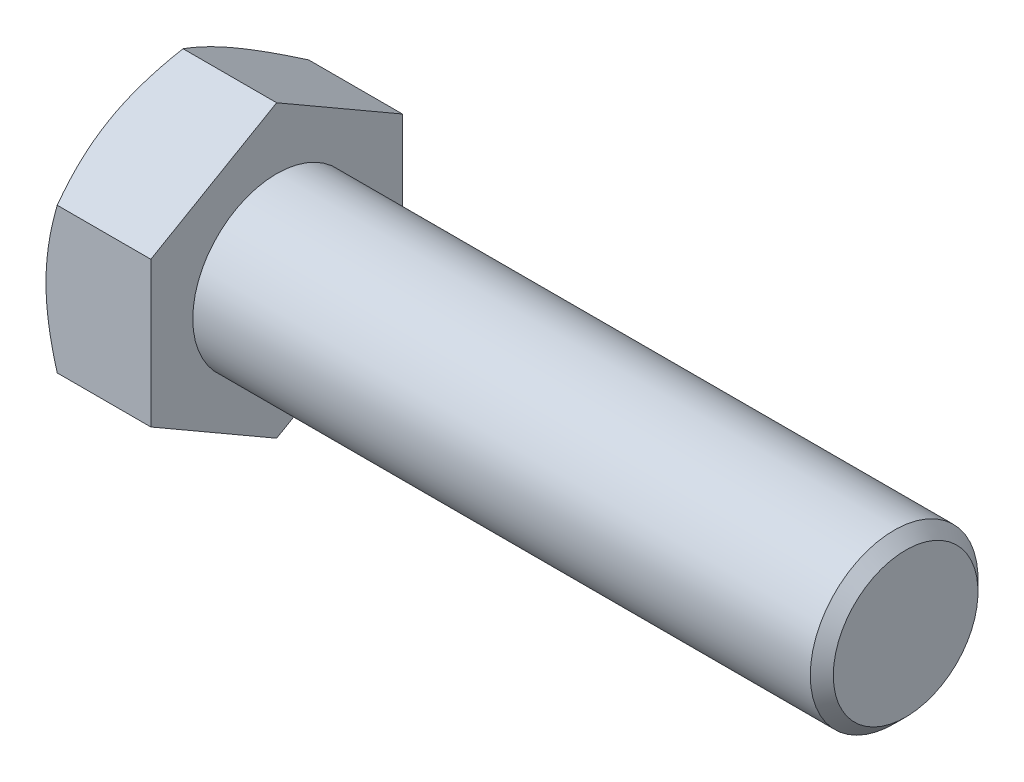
SolidWorks part; units mm, degrees
ref_plane "Front Plane" through (0, 0, 0) normal (0, 0, 1) x (1, 0, 0)
ref_plane "Top Plane" through (0, 0, 0) normal (0, 1, 0) x (1, 0, 0)
ref_plane "Right Plane" through (0, 0, 0) normal (1, 0, 0) x (0, 0, -1)
sketch "BaseHeadSke" plane through (0, 0, 0) normal (1, 0, 0) x (0, 0, -1)
  line L1 (0, 20.7846) -> (-18, 10.3923)
  line L2 (-18, 10.3923) -> (-18, -10.3923)
  line L3 (-18, -10.3923) -> (0, -20.7846)
  line L4 (0, -20.7846) -> (18, -10.3923)
  line L5 (18, -10.3923) -> (18, 10.3923)
  line L6 (18, 10.3923) -> (0, 20.7846)
  circle A0 centre (0, 0) radius 18 construction
  dimension "Width_flats" = 36
extrude "BaseHead" add sketch "BaseHeadSke" along normal blind 15
sketch "HeadChamferSke" plane through (0, 0, 0) normal (0, 0, 1) x (1, 0, 0)
  line L0 (0, 0) -> (59.4924, 0) construction
  line L1 (0, 10.3923) -> (0, -10.3923) construction
  line L2 (0, 20.7846) -> (0, 18)
  line L3 (0, 18) -> (1.6077, 20.7846)
  line L4 (1.6077, 20.7846) -> (0, 20.7846)
  line L7 (15, 20.7846) -> (0, 20.7846) construction
  dimension "Angle_Chamfer_Head" = 30
revolve "HeadChamfer" cut sketch "HeadChamferSke" angle 360 about L0
sketch "BodySke" plane through (0, 0, 0) normal (0, 0, 1) x (1, 0, 0)
  line L0 (0, 0) -> (134.9018, 0) construction
  line L1 (0, 0) -> (0, 12)
  line L2 (0, 12) -> (103.352, 12)
  line L3 (105, 10.352) -> (105, 0)
  line L4 (105, 0) -> (0, 0)
  line L5 (15, 10.3923) -> (15, -10.3923) construction
  line L6 (103.352, 12) -> (105, 10.352)
  line L7 (18, 0) -> (18, 20.3478) construction
  dimension "Diameter" = 24
  dimension "Length" = 90
  dimension "Thread_minor" = 20.704
  dimension "Body_Chamfer_Angle" = 45
  dimension "Advance" = 3
revolve "BaseBody" add sketch "BodySke" angle 360 about L0
sketch "BearingFaceSke" plane through (0, 0, 0) normal (0, 0, 1) x (1, 0, 0)
  line L0 (0, 0) -> (129.635, 0) construction
  line L1 (15, 20.7846) -> (15, 10.3923) construction
  line L2 (15, 18) -> (14.2, 18)
  line L3 (15, 18) -> (15, 28)
  line L4 (15, 28) -> (14.2, 28)
  line L5 (14.2, 18) -> (14.2, 28)
  dimension "D1" = 10
  dimension "D2" = 36
  dimension "Bearing_height" = 0.8
revolve "BearingFace" [suppressed] cut sketch "BearingFaceSke" angle 360 about L0
fillet "HeadFillet" [suppressed] radius 0.8
sketch "ThdSchSke" plane through (0, 0, 0) normal (0, 0, 1) x (1, 0, 0)
  line L0 (0, 0) -> (122.6446, 0) construction
  line L1 (100.352, 13.9029) -> (100.352, 12)
  line L2 (100.352, 13.9029) -> (102.2549, 13.9029)
  line L3 (102.2549, 13.9029) -> (102.2549, 12)
  line L4 (102.2549, 12) -> (101.3035, 10.352)
  line L5 (101.3035, 10.352) -> (100.352, 12)
  dimension "D1" = 3
revolve "ThreadSchematic" [suppressed] cut sketch "ThdSchSke" angle 360 about L0
pattern_linear "ThdSchPat" [suppressed]
equation "\"Thread_minor@ThreadCosmetic\" = \"Thread_minor@BodySke\""
equation "\"D2@BearingFaceSke\" = \"Width_flats@BaseHeadSke\""
equation "\"D1@ThdSchSke\" = \"Advance@BodySke\""
equation "\"Advance@ThdSchPat\" = \"Advance@BodySke\""
equation "\"Tooth_Num@ThdSchPat\" =  int( \"Length@BodySke\" / \"Advance@BodySke\" )  - 1"
